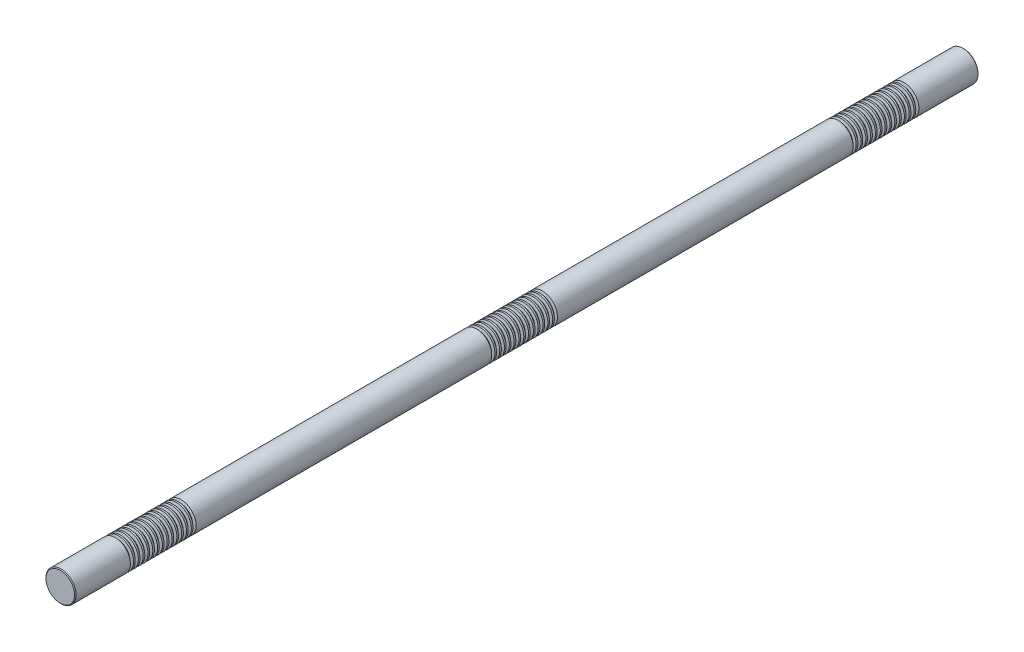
SolidWorks part; units mm, degrees
ref_plane "Front Plane" through (0, 0, 0) normal (0, 0, 1) x (1, 0, 0)
ref_plane "Top Plane" through (0, 0, 0) normal (0, 1, 0) x (1, 0, 0)
ref_plane "Right Plane" through (0, 0, 0) normal (1, 0, 0) x (0, 0, -1)
sketch "Sketch1" plane through (0, 0, 0) normal (0, 0, 1) x (1, 0, 0)
  circle A0 centre (0, 0) radius 25
  dimension "D1" = 50
extrude "Boss-Extrude1" add sketch "Sketch1" along normal mid plane 1500
chamfer "Chamfer1" distance 1.25 angle 45 2 edges at (25, 0, -750) (25, 0, 750)
sketch "Sketch2" plane through (0, 0, 0) normal (1, 0, 0) x (0, 0, -1)
  line L0 (650.6029, 25) -> (645.3971, 25)
  line L1 (748.75, 25) -> (-748.75, 25) construction
  line L2 (645.3971, 25) -> (646.6029, 20.5)
  line L3 (646.6029, 20.5) -> (649.3971, 20.5)
  line L4 (649.3971, 20.5) -> (650.6029, 25)
  line L5 (750, -23.75) -> (750, 23.75) construction
  point P4 (648, 25)
  point P7 (648, 20.5)
  point P8 (650, 22.75)
  point P9 (646, 22.75)
  dimension "D1" = 4
  dimension "D2" = 100
  dimension "D3" = 4.5
  dimension "D4" = 30
revolve "Cut-Revolve1" cut sketch "Sketch2" angle 360 about axis through (0, 0, 750) along (0, 0, -1)
pattern_linear "LPattern1" count 14 spacing 8 along (0, 0, 1) of "Cut-Revolve1"
pattern_linear "LPattern2" count 3 spacing 600 along (0, 0, 1) of "Cut-Revolve1", "LPattern1"
